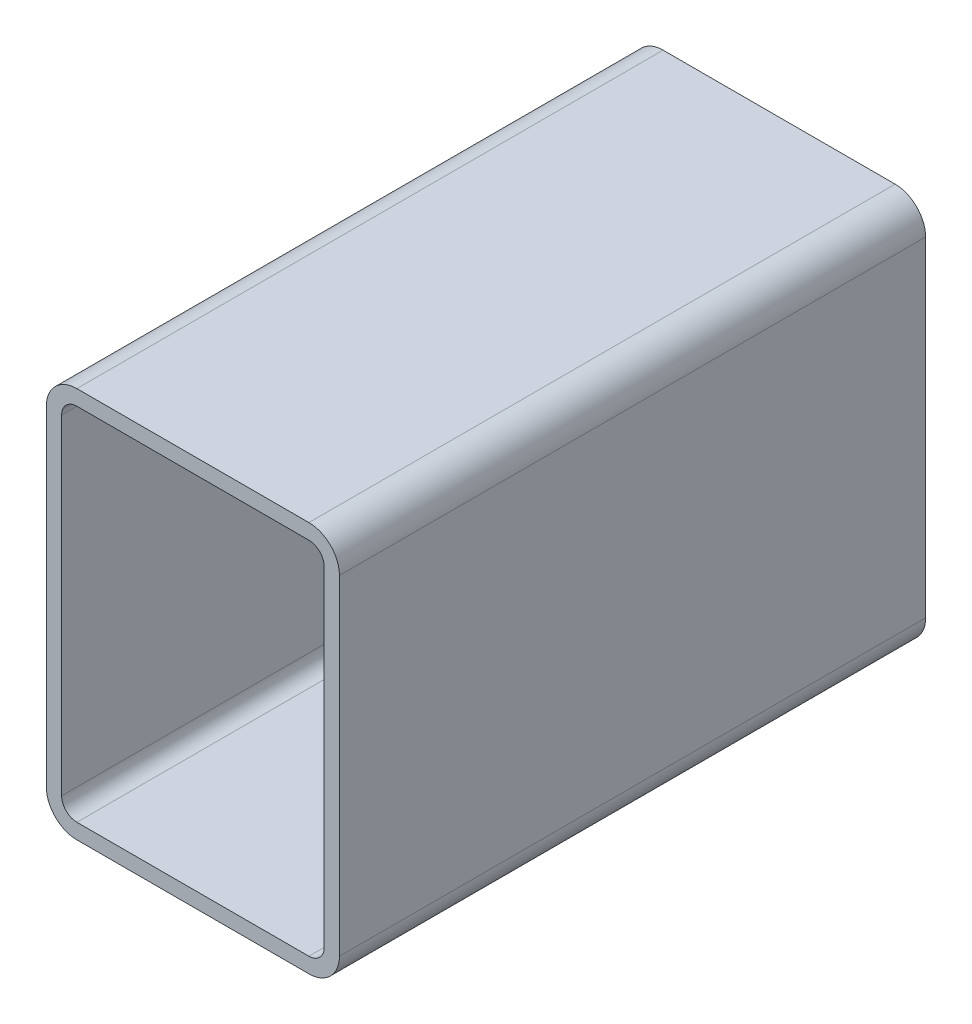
SolidWorks part; units mm, degrees
ref_plane "Front Plane" through (0, 0, 0) normal (0, 0, 1) x (1, 0, 0)
ref_plane "Top Plane" through (0, 0, 0) normal (0, 1, 0) x (1, 0, 0)
ref_plane "Right Plane" through (0, 0, 0) normal (1, 0, 0) x (0, 0, -1)
sketch "Sketch1" plane through (0, 0, 0) normal (0, 0, 1) x (1, 0, 0)
sketch_block_instance "HSS8x6x0.3125-1"
sketch_block "HSS8x6x0.3125"
extrude "Boss-Extrude1" add sketch "Sketch1" along normal blind 304.8
